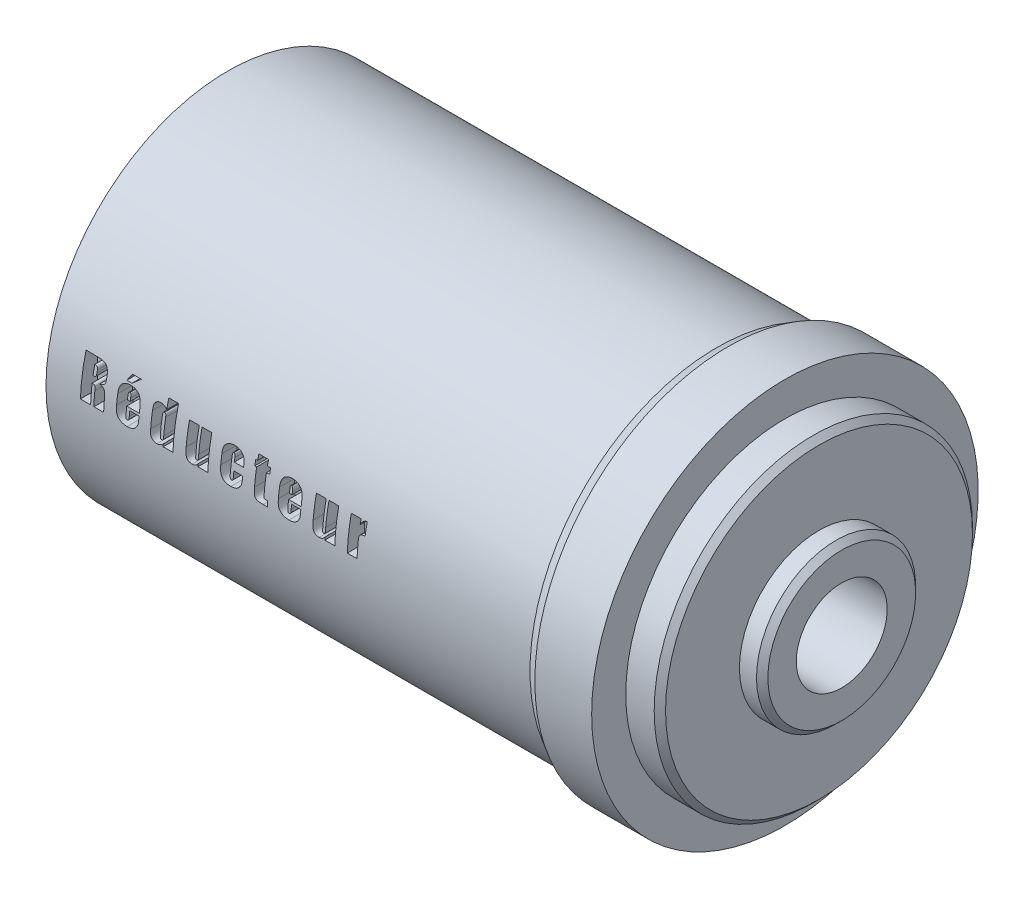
SolidWorks part; units mm, degrees
ref_plane "Plane1" through (0, 0, 0) normal (0, 0, 1) x (1, 0, 0)
ref_plane "Plane2" through (0, 0, 0) normal (0, 1, 0) x (1, 0, 0)
ref_plane "Plane3" through (0, 0, 0) normal (1, 0, 0) x (0, 0, -1)
sketch "Esquisse1" plane through (0, 0, 0) normal (0, 0, 1) x (1, 0, 0)
  line L0 (-5, 0) -> (-5, 4)
  line L1 (-5, 4) -> (5, 4)
  line L2 (5, 4) -> (5, 7)
  line L3 (5, 7) -> (3, 7)
  line L4 (3, 7) -> (3, 14)
  line L5 (3, 14) -> (0, 14)
  line L6 (0, 14) -> (0, 17)
  line L7 (0, 17) -> (-6, 17)
  line L8 (-6, 17) -> (-6, 16)
  line L9 (-6, 16) -> (-49, 16)
  line L10 (-49, 16) -> (-49, 6)
  line L11 (-49, 6) -> (-48, 6)
  line L12 (-48, 6) -> (-48, 3)
  line L13 (-48, 3) -> (-36, 3)
  line L14 (-36, 3) -> (-36, 0)
  line L15 (-36, 0) -> (-5, 0)
  line L16 (-41.5, 0) -> (6, 0) construction
revolve "Base-Révolution" add sketch "Esquisse1" angle 360 about L16
chamfer "Chanfrein1" distance 0.5 angle 45
chamfer "Chanfrein2" distance 0.5 angle 45
chamfer "Chanfrein3" distance 1 angle 30
sketch "Esquisse2" plane through (-49, 0, 0) normal (-1, 0, 0) x (0, 0, 1)
  line L0 (-1, 4.5) -> (1, 4.5)
  line L1 (-1, 4.5) -> (-1, 2)
  line L2 (1, 2) -> (-1, 2)
  line L3 (1, 2) -> (1, 4.5)
  dimension "D1" = 1
extrude "Enlèv. mat.-Extru.1" cut sketch "Esquisse2" against normal blind 12
sketch "Esquisse3" plane through (-5, 0, 0) normal (1, 0, 0) x (0, 0, -1)
  circle A0 centre (0, 0) radius 4.0311
extrude "Enlèv. mat.-Extru.2" cut sketch "Esquisse3" against normal blind 20
ref_plane "Plan4" through (0, 0, 15.5) normal (0, 0, 1) x (1, 0, 0)
sketch "Esquisse4" plane through (0, 0, 15.5) normal (0, 0, 1) x (1, 0, 0)
  text T0 "R é d u c t e u r" font "Impact" height 3.5
  point P1 (0, 0)
extrude "Enlèv. mat.-Extru.3" cut sketch "Esquisse4" against normal mid plane 2
